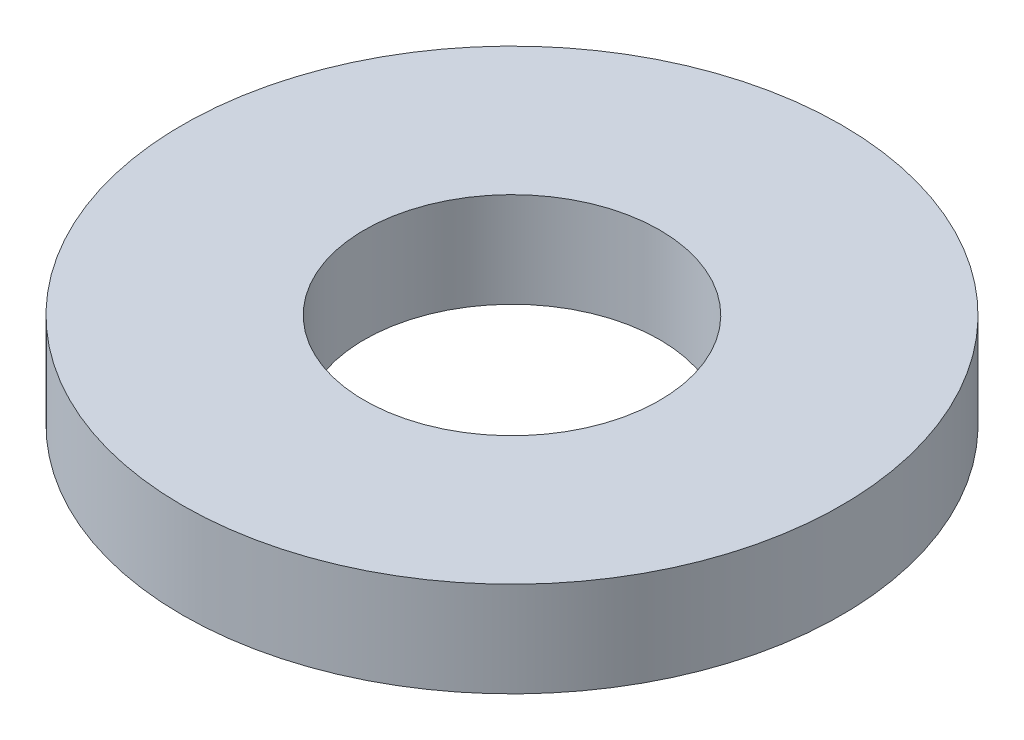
SolidWorks part; units mm, degrees
ref_plane "Front" through (0, 0, 0) normal (0, 0, 1) x (1, 0, 0)
ref_plane "Top" through (0, 0, 0) normal (0, 1, 0) x (1, 0, 0)
ref_plane "Right" through (0, 0, 0) normal (1, 0, 0) x (0, 0, -1)
sketch "Sketch1" plane through (0, 0, 0) normal (0, 1, 0) x (1, 0, 0)
  circle A0 centre (0, 0) radius 3.5433
  dimension "D1" = 7.0866
extrude "Extrude1" add sketch "Sketch1" along normal blind 1.0211
sketch "Sketch2" plane through (0, 0, 0) normal (0, -1, 0) x (1, 0, 0)
  circle A0 centre (0, 0) radius 1.5875
  dimension "D1" = 3.175
extrude "Cut-Extrude1" cut sketch "Sketch2" against normal through all
